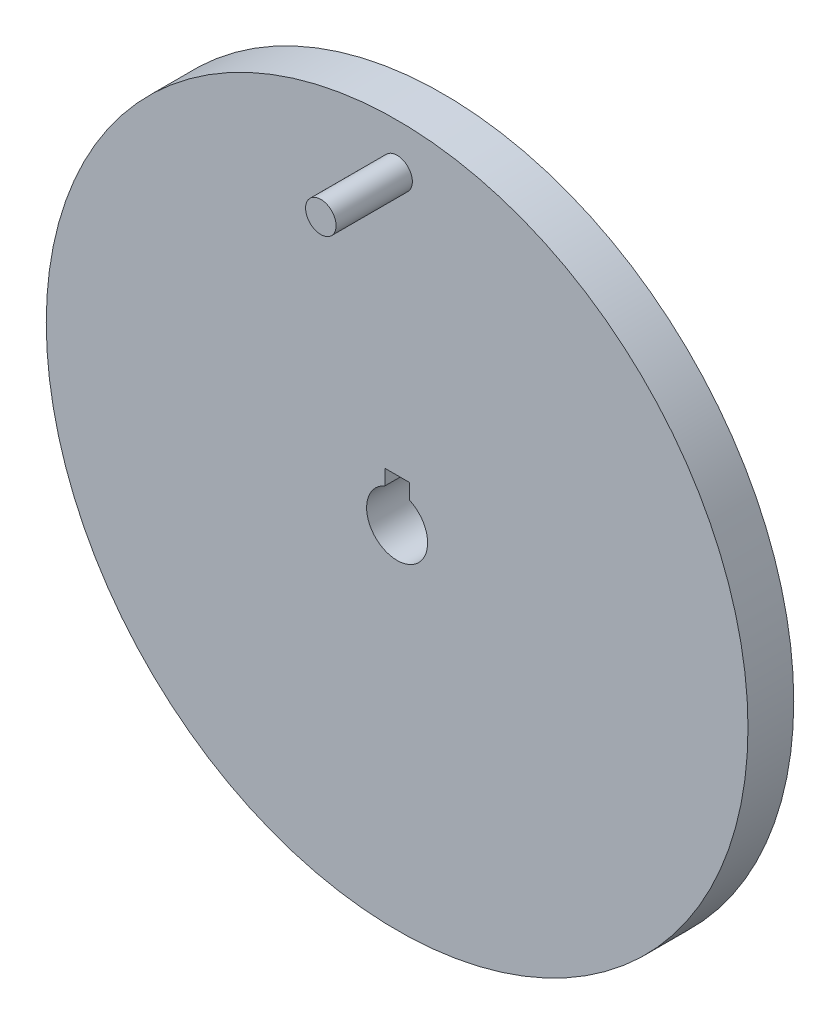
SolidWorks part; units mm, degrees
ref_plane "Front Plane" through (0, 0, 0) normal (0, 0, 1) x (1, 0, 0)
ref_plane "Top Plane" through (0, 0, 0) normal (0, 1, 0) x (1, 0, 0)
ref_plane "Right Plane" through (0, 0, 0) normal (1, 0, 0) x (0, 0, -1)
sketch "Sketch1" plane through (0, 0, 0) normal (0, 0, 1) x (1, 0, 0)
  circle A0 centre (0, 0) radius 100 construction
  circle A1 centre (0, 0) radius 115
  circle A2 centre (0, 0) radius 85 construction
  dimension "D1" = 200
  dimension "D2" = 15
  dimension "D3" = 15
extrude "Extrude1" add sketch "Sketch1" against normal blind 15
sketch "Sketch2" plane through (0, 0, 0) normal (0, 0, 1) x (1, 0, 0)
  circle A0 centre (0, 0) radius 100 construction
  circle A1 centre (0, 0) radius 100 construction
  circle A2 centre (0, 100) radius 5
  dimension "D1" = 10
extrude "Extrude2" add sketch "Sketch2" along normal blind 25
sketch "Sketch3" plane through (0, 0, 0) normal (0, 0, 1) x (1, 0, 0)
  line L0 (0, 0) -> (0, 14.1652) construction
  line L1 (4, 9.1652) -> (4, 14.1652)
  line L2 (-4, 9.1652) -> (-4, 14.1652)
  line L4 (4, 14.1652) -> (-4, 14.1652)
  line L5 (-4, 0) -> (-4, 14.1652) construction
  line L6 (4, 0) -> (4, 14.1652) construction
  arc A0 (-4, 9.1652) -> (4, 9.1652) centre (0, 0) ccw
  dimension "D3" = 10
  dimension "D4" = 5
  dimension "D1" = 4
  dimension "D2" = 4
extrude "Cut-Extrude1" cut sketch "Sketch3" against normal through all
